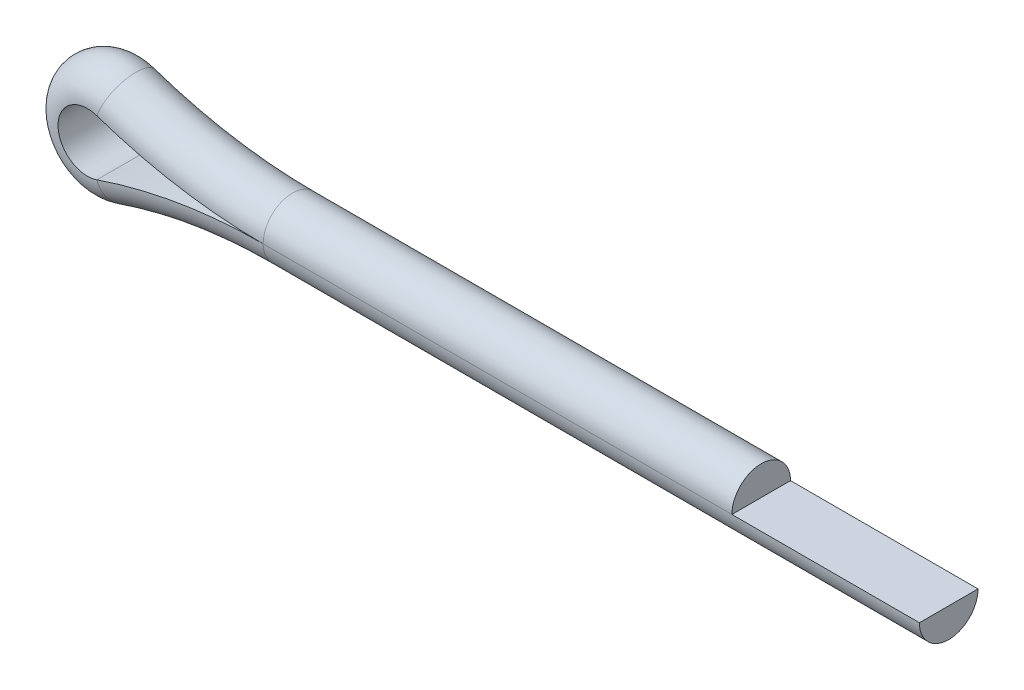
SolidWorks part; units mm, degrees
ref_plane "Front" through (0, 0, 0) normal (0, 0, 1) x (1, 0, 0)
ref_plane "Top" through (0, 0, 0) normal (0, 1, 0) x (1, 0, 0)
ref_plane "Right" through (0, 0, 0) normal (1, 0, 0) x (0, 0, -1)
ref_plane "Plane1" through (6, 0, 0) normal (1, 0, 0) x (0, 0, -1)
sketch "PathSke" plane through (1.208, 1.808, 0) normal (0, 0, 1) x (0, 1, 0)
  line L0 (-1.558, -4.792) -> (-1.558, -0.792)
  line L1 (-2.058, -0.792) -> (-2.058, -6.392)
  line L2 (-1.808, 1.208) -> (-1.808, -5.7761) construction
  arc A0 (-2.058, -0.792) -> (-2.2809, 0.5458) centre (-6.183, -0.792) ccw
  arc A1 (-1.558, -0.792) -> (-1.335, 0.5458) centre (2.567, -0.792) cw
  arc A3 (-1.335, 0.5458) -> (-2.2809, 0.5458) centre (-1.808, 0.708) ccw
  dimension "C" = 1
  dimension "d" = 0.5
  dimension "d/2" = 0.25
  dimension "l" = 4
  dimension "a" = 1.6
  dimension "b" = 2
sketch "SectionSke" plane through (6, 0.15, 0.15) normal (1, 0, 0) x (0, 1, 0)
  line L0 (-0.15, -0.4) -> (-0.15, 0.1)
  arc A0 (-0.15, -0.4) -> (-0.15, 0.1) centre (-0.15, -0.15) ccw
  dimension "R" = 0.25
  dimension "d1" = 0.5
sweep "Body" add profiles "SectionSke" path "PathSke"
equation "\"d/2@PathSke\" = \"d@PathSke\" / 2"
equation "\"R@SectionSke\" = \"d@PathSke\" / 2"
equation "\"d1@SectionSke\" = \"d@PathSke\""
equation "\"D1@Plane1\" = \"b@PathSke\" + \"l@PathSke\""
